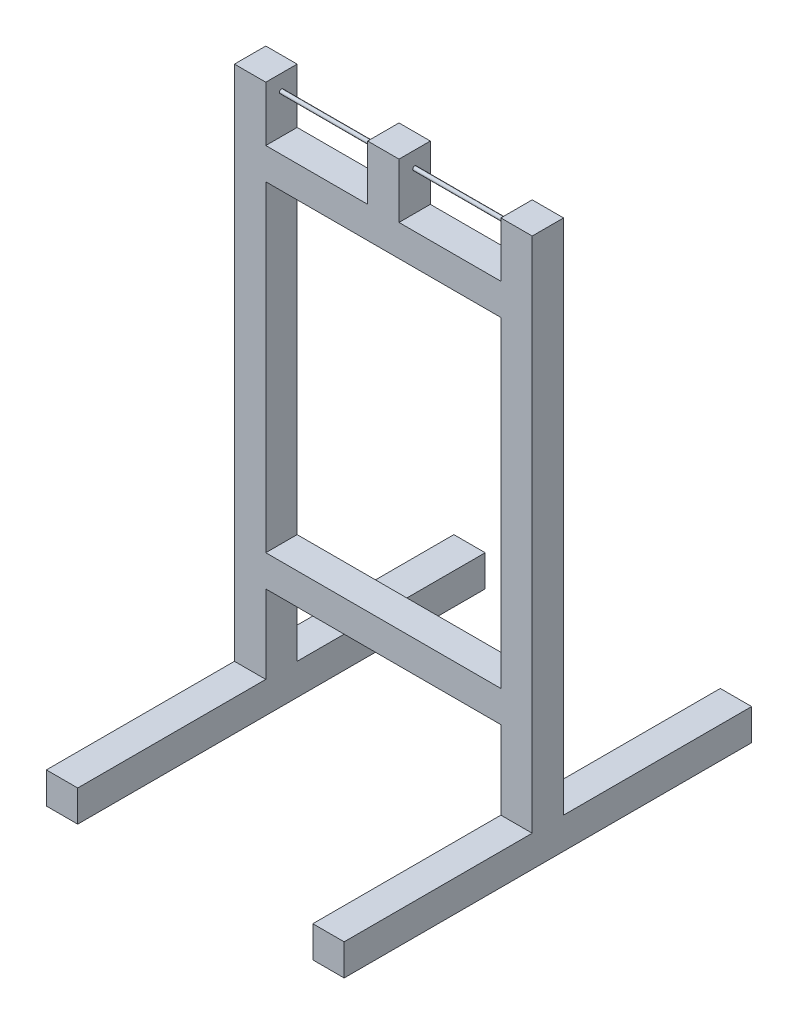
SolidWorks part; units mm, degrees
ref_plane "Plan de face" through (0, 0, 0) normal (0, 0, 1) x (1, 0, 0)
ref_plane "Plan de dessus" through (0, 0, 0) normal (0, 1, 0) x (1, 0, 0)
ref_plane "Plan de droite" through (0, 0, 0) normal (1, 0, 0) x (0, 0, -1)
sketch "Esquisse1" plane through (0, 0, 0) normal (0, 0, 1) x (1, 0, 0)
  line L1 (-12.7, -12.7) -> (12.7, -12.7)
  line L2 (-12.7, -12.7) -> (-12.7, 12.7)
  line L3 (-12.7, 12.7) -> (12.7, 12.7)
  line L4 (12.7, -12.7) -> (12.7, 12.7)
  line L5 (-12.7, -12.7) -> (12.7, 12.7) construction
  line L6 (-12.7, 12.7) -> (12.7, -12.7) construction
  point P0 (0, 0)
  dimension "D1" = 25.4
  dimension "D2" = 25.4
extrude "Boss.-Extru.1" add sketch "Esquisse1" along normal mid plane 330.2
sketch "Esquisse2" plane through (0, 0, 0) normal (0, 1, 0) x (1, 0, 0)
  line L1 (-12.7, -12.7) -> (12.7, -12.7)
  line L2 (-12.7, -12.7) -> (-12.7, 12.7)
  line L3 (-12.7, 12.7) -> (12.7, 12.7)
  line L4 (12.7, -12.7) -> (12.7, 12.7)
  line L5 (-12.7, -12.7) -> (12.7, 12.7) construction
  line L6 (-12.7, 12.7) -> (12.7, -12.7) construction
  point P0 (0, 0)
  dimension "D1" = 25.4
  dimension "D2" = 25.4
extrude "Boss.-Extru.2" add sketch "Esquisse2" along normal blind 431.8
pattern_linear "Répétition linéaire1" count 2 spacing 215.9 along (1, 0, 0)
sketch "Esquisse3" plane through (0, 0, 0) normal (1, 0, 0) x (0, 0, -1)
  line L5 (-12.7, 76.2) -> (12.7, 76.2)
  line L6 (-12.7, 76.2) -> (-12.7, 101.6)
  line L7 (-12.7, 101.6) -> (12.7, 101.6)
  line L8 (12.7, 76.2) -> (12.7, 101.6)
  line L9 (-12.7, 76.2) -> (12.7, 101.6) construction
  line L10 (-12.7, 101.6) -> (12.7, 76.2) construction
  point P0 (0, 88.9)
  dimension "D1" = 25.4
  dimension "D2" = 25.4
  dimension "D3" = 88.9
  dimension "D4" = 0
extrude "Boss.-Extru.3" add sketch "Esquisse3" along normal up to next (203.2 mm away) from surface at 12.7
pattern_linear "Répétition linéaire2" count 2 spacing 285.75 along (0, 1, 0) of "Boss.-Extru.3"
sketch "Esquisse4" plane through (12.7, 0, 0) normal (1, 0, 0) x (0, 0, -1)
  line L1 (-12.7, 431.8) -> (-12.7, 12.7) construction
  circle A0 centre (0, 419.1) radius 1.5875
  dimension "D1" = 3.175
  dimension "D2" = 12.7
  dimension "D3" = 12.7
extrude "Boss.-Extru.4" add sketch "Esquisse4" along normal up to next
sketch "Esquisse6" plane through (0, 387.35, 0) normal (0, 1, 0) x (1, 0, 0)
  line L0 (12.7, 12.7) -> (12.7, 165.1) construction
  line L1 (95.25, -12.7) -> (120.65, -12.7)
  line L2 (95.25, -12.7) -> (95.25, 12.7)
  line L3 (95.25, 12.7) -> (120.65, 12.7)
  line L4 (120.65, -12.7) -> (120.65, 12.7)
  line L5 (95.25, -12.7) -> (120.65, 12.7) construction
  line L6 (95.25, 12.7) -> (120.65, -12.7) construction
  line L7 (203.2, 12.7) -> (12.7, 12.7) construction
  point P0 (107.95, 0)
  dimension "D1" = 25.4
  dimension "D2" = 25.4
  dimension "D3" = 95.25
  dimension "D4" = 12.7
extrude "Boss.-Extru.5" add sketch "Esquisse6" along normal blind 44.45
sketch "Esquisse7" plane through (0, 0, 0) normal (0, 0, 1) x (1, 0, 0)
  line L0 (12.7, 419.1) -> (203.2, 419.1) construction
  line L1 (12.7, 417.5125) -> (12.7, 420.6875) construction
  line L2 (203.2, 420.6875) -> (203.2, 417.5125) construction
ref_point "Point1"
